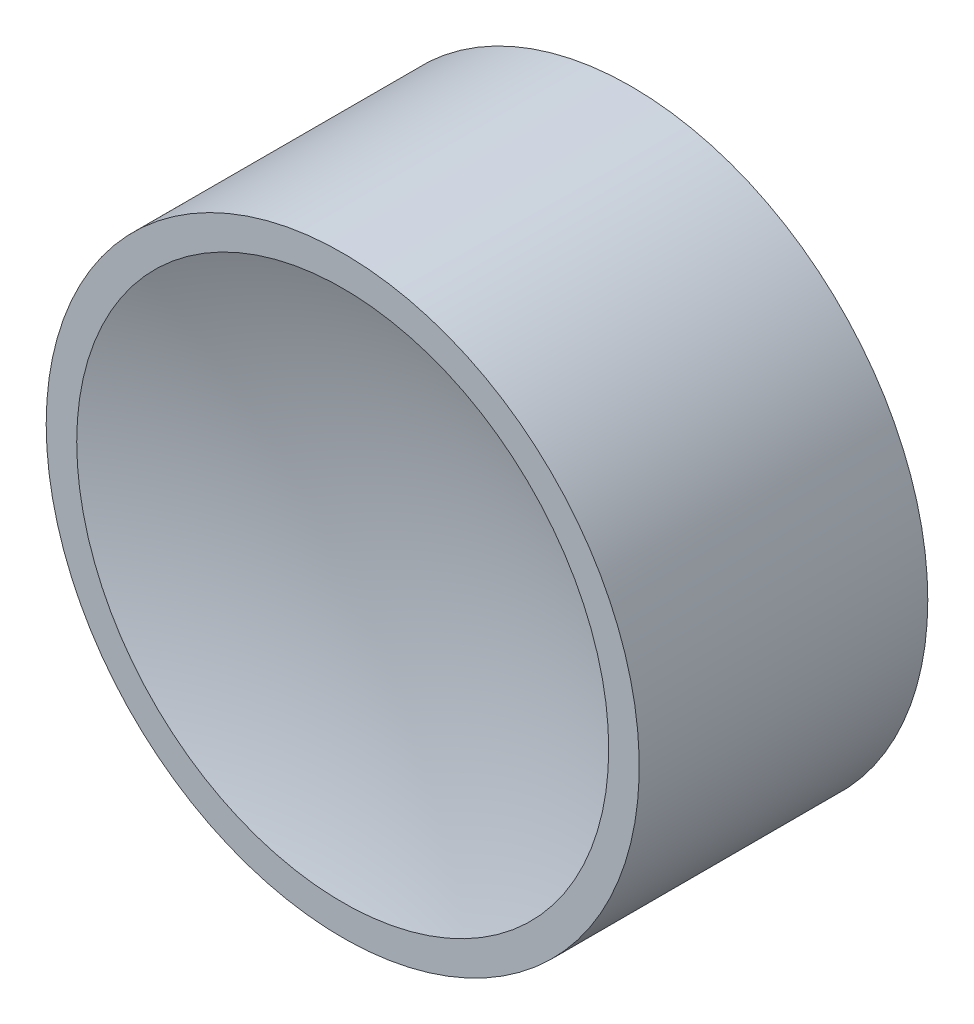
SolidWorks part; units mm, degrees
ref_plane "Front Plane" through (0, 0, 0) normal (0, 0, 1) x (1, 0, 0)
ref_plane "Top Plane" through (0, 0, 0) normal (0, 1, 0) x (1, 0, 0)
ref_plane "Right Plane" through (0, 0, 0) normal (1, 0, 0) x (0, 0, -1)
sketch "Sketch1" plane through (0, 0, 0) normal (0, 0, 1) x (1, 0, 0)
  circle A0 centre (0, 0) radius 17
  dimension "D1" = 34
extrude "Boss-Extrude1" add sketch "Sketch1" along normal blind 17.217
sketch "Sketch4" plane through (0, 0, 0) normal (0, 1, 0) x (1, 0, 0)
  line L1 (17, -17.217) -> (0, -17.217)
  line L2 (-17, -17.217) -> (17, -17.217) construction
  line L3 (0, -17.217) -> (0, -13.8777)
  arc A0 (-17, -17.217) -> (17, -17.217) centre (0, -58.8197) cw construction
  arc A1 (0, -13.8777) -> (17, -17.217) centre (0, -58.8197) cw
  dimension "D1" = 44.942
sketch "Sketch5" plane through (0, 0, 0) normal (0, 1, 0) x (1, 0, 0)
  line L0 (17, 0) -> (0, 0)
  line L1 (0, 0) -> (0, 4.8995) construction
  line L2 (0, 0) -> (0, 2.3094)
  arc A0 (17, 0) -> (-17, 0) centre (0, -61.4156) ccw construction
  arc A1 (17, 0) -> (0, 2.3094) centre (0, -61.4156) ccw
  dimension "D1" = 63.725
revolve "Revolve2" add sketch "Sketch5" angle 360 about L1
revolve "Cut-Revolve1" cut sketch "Sketch4" angle 360 about L3
ref_plane "Plane1" through (0, 0, 13.8777) normal (0, 0, 1) x (1, 0, 0)
ref_plane "Plane2" through (0, 0, -2.3094) normal (0, 0, -1) x (-1, 0, 0)
sketch "Sketch6" plane through (0, 0, 0) normal (0, 1, 0) x (1, 0, 0)
  line L0 (0, 0) -> (0, -50000) construction
  line L2 (17, -17.217) -> (-17, -17.217) construction
  line L3 (-17, -17.217) -> (-15.25, -17.217)
  line L4 (-17, -17.217) -> (-17, -16.5441)
  line L5 (-17, -16.5441) -> (-15.25, -16.5441)
  line L6 (-15.25, -17.217) -> (-15.25, -16.5441)
  arc A0 (17, -17.217) -> (-17, -17.217) centre (0, -58.8197) ccw construction
  dimension "D5" = 44.942
  dimension "D1" = 15.25
  dimension "D4" = 34
revolve "Cut-Revolve2" cut sketch "Sketch6" angle 360 about L0
